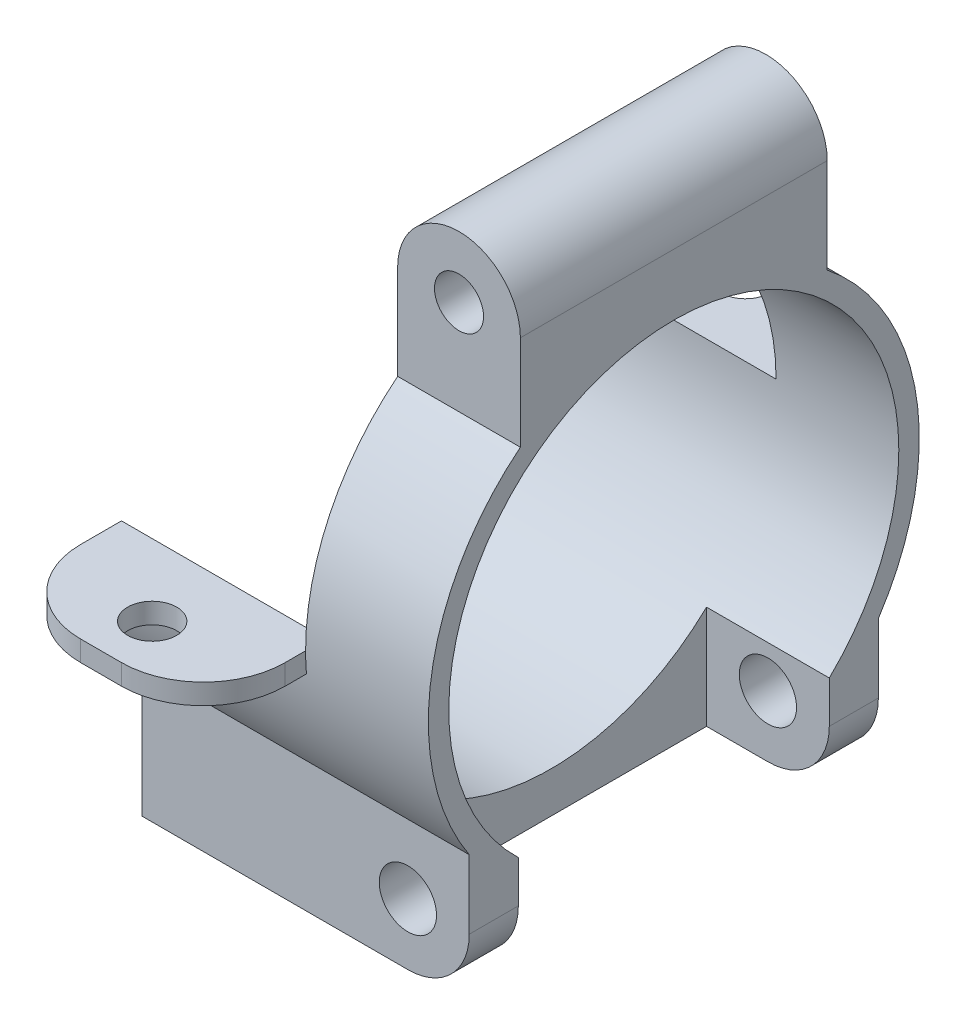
SolidWorks part; units mm, degrees
ref_plane "Front Plane" through (0, 0, 0) normal (0, 0, 1) x (1, 0, 0)
ref_plane "Top Plane" through (0, 0, 0) normal (0, 1, 0) x (1, 0, 0)
ref_plane "Right Plane" through (0, 0, 0) normal (1, 0, 0) x (0, 0, -1)
sketch "Sketch1" plane through (0, 0, 0) normal (0, 0, 1) x (1, 0, 0)
  line L0 (0, 0) -> (0, 30.48) construction
  line L1 (-3.81, 0) -> (-3.81, 30.48)
  line L2 (3.81, 0) -> (3.81, 30.48)
  arc A0 (-3.81, 0) -> (3.81, 0) centre (0, 0) ccw
  arc A1 (3.81, 30.48) -> (-3.81, 30.48) centre (0, 30.48) ccw
  point P3 (0, 15.24)
  dimension "D2" = 3.81
  dimension "D1" = 30.48
extrude "Boss-Extrude1" add sketch "Sketch1" along normal mid plane 19.05
sketch "Sketch2" plane through (3.81, 0, 0) normal (1, 0, 0) x (0, 0, -1)
  circle A0 centre (0, 12.7) radius 15.24
  dimension "D1" = 30.48
  dimension "D2" = 12.7
extrude "Boss-Extrude2" add sketch "Sketch2" against normal blind 7.62
sketch "Sketch3" plane through (0, 0, 0) normal (0, 0, 1) x (1, 0, 0)
  line L0 (0, 0) -> (0, 12.0187) construction
  line L1 (-3.81, 0) -> (-3.81, 12.0187)
  line L2 (3.81, 0) -> (3.81, 12.0187)
  line L3 (-3.81, 12.0187) -> (3.81, 12.0187)
  arc A0 (-3.81, 0) -> (3.81, 0) centre (0, 0) ccw
  point P4 (0, 6.0093)
  dimension "D1" = 3.81
extrude "Boss-Extrude3" add sketch "Sketch3" along normal mid plane 25.4
sketch "Sketch5" plane through (3.81, 0, 0) normal (1, 0, 0) x (0, 0, -1)
  circle A0 centre (0, 12.7) radius 13.97
  dimension "D1" = 27.94
extrude "Cut-Extrude1" cut sketch "Sketch5" against normal through all
sketch "Sketch6" plane through (0, 0, 12.7) normal (0, 0, 1) x (1, 0, 0)
  circle A0 centre (0, 0) radius 1.778
  circle A1 centre (0, 30.48) radius 1.524
  dimension "D1" = 3.556
  dimension "D2" = 3.048
sketch "Sketch7" plane through (-3.81, 0, 0) normal (-1, 0, 0) x (0, 0, 1)
  line L0 (-12.7, -3.81) -> (-12.7, 4.2758)
  line L1 (-12.7, -3.81) -> (12.7, -3.81)
  line L2 (12.7, -3.81) -> (12.7, 4.2758)
  line L3 (-15.24, 12.7) -> (-13.97, 12.7)
  line L4 (13.97, 12.7) -> (15.24, 12.7)
  arc A0 (-13.97, 12.7) -> (13.97, 12.7) centre (0, 12.7) ccw
  arc A1 (-15.24, 12.7) -> (-12.7, 4.2758) centre (0, 12.7) ccw
  arc A2 (12.7, 4.2758) -> (15.24, 12.7) centre (0, 12.7) ccw
extrude "Boss-Extrude4" add sketch "Sketch7" along normal blind 12.7 and the other way blind 3.81
extrude "Cut-Extrude3" cut sketch "Sketch6" against normal through all
sketch "Sketch8" plane through (3.81, 0, 0) normal (1, 0, 0) x (0, 0, -1)
  line L0 (0, 8.4015) -> (0, -8.4015) construction
  line L1 (-9.652, -5.2062) -> (9.652, -5.2062)
  line L2 (-9.652, -5.2062) -> (-9.652, 7.2604)
  line L3 (-9.652, 7.2604) -> (9.652, 7.2604)
  line L4 (9.652, -5.2062) -> (9.652, 7.2604)
  line L5 (-12.7, 0) -> (-12.7, 4.2758) construction
  line L6 (12.7, -3.81) -> (12.7, 0) construction
  point P8 (0, 0)
  dimension "D1" = 3.048
  dimension "D2" = 3.048
extrude "Cut-Extrude4" cut sketch "Sketch8" against normal blind 7.62
sketch "Sketch9" plane through (0, 12.7, 0) normal (0, 1, 0) x (1, 0, 0)
  line L0 (-3.81, 15.24) -> (-16.51, 15.24) construction
  line L1 (-3.81, 13.97) -> (-16.51, 13.97)
  line L2 (-3.81, 13.97) -> (-3.81, 16.51)
  line L3 (-8.89, 21.59) -> (-11.43, 21.59)
  line L4 (-16.51, 13.97) -> (-16.51, 16.51)
  line L5 (0, 0) -> (-19.8812, 0) construction
  line L6 (-8.89, -21.59) -> (-11.43, -21.59)
  line L7 (-16.51, -13.97) -> (-16.51, -16.51)
  line L8 (-3.81, -13.97) -> (-16.51, -13.97)
  line L9 (-3.81, -13.97) -> (-3.81, -16.51)
  arc A0 (-3.81, 16.51) -> (-8.89, 21.59) centre (-8.89, 16.51) ccw
  arc A1 (-11.43, 21.59) -> (-16.51, 16.51) centre (-11.43, 16.51) ccw
  arc A2 (-11.43, -21.59) -> (-16.51, -16.51) centre (-11.43, -16.51) cw
  arc A3 (-3.81, -16.51) -> (-8.89, -21.59) centre (-8.89, -16.51) cw
  point P12 (-3.81, 21.59)
  point P15 (-16.51, 21.59)
  dimension "D3" = 5.08
  dimension "D1" = 12.7
  dimension "D2" = 6.35
extrude "Boss-Extrude5" add sketch "Sketch9" against normal blind 1.27
sketch "Sketch10" plane through (0, 12.7, 0) normal (0, 1, 0) x (1, 0, 0)
  line L0 (0, 0) -> (-19.3006, 0) construction
  line L1 (-8.89, 21.59) -> (-11.43, 21.59) construction
  circle A0 centre (-10.16, 18.415) radius 1.524
  circle A1 centre (-10.16, -18.415) radius 1.524
  dimension "D1" = 3.048
  dimension "D2" = 3.175
extrude "Cut-Extrude5" cut sketch "Sketch10" against normal through all
